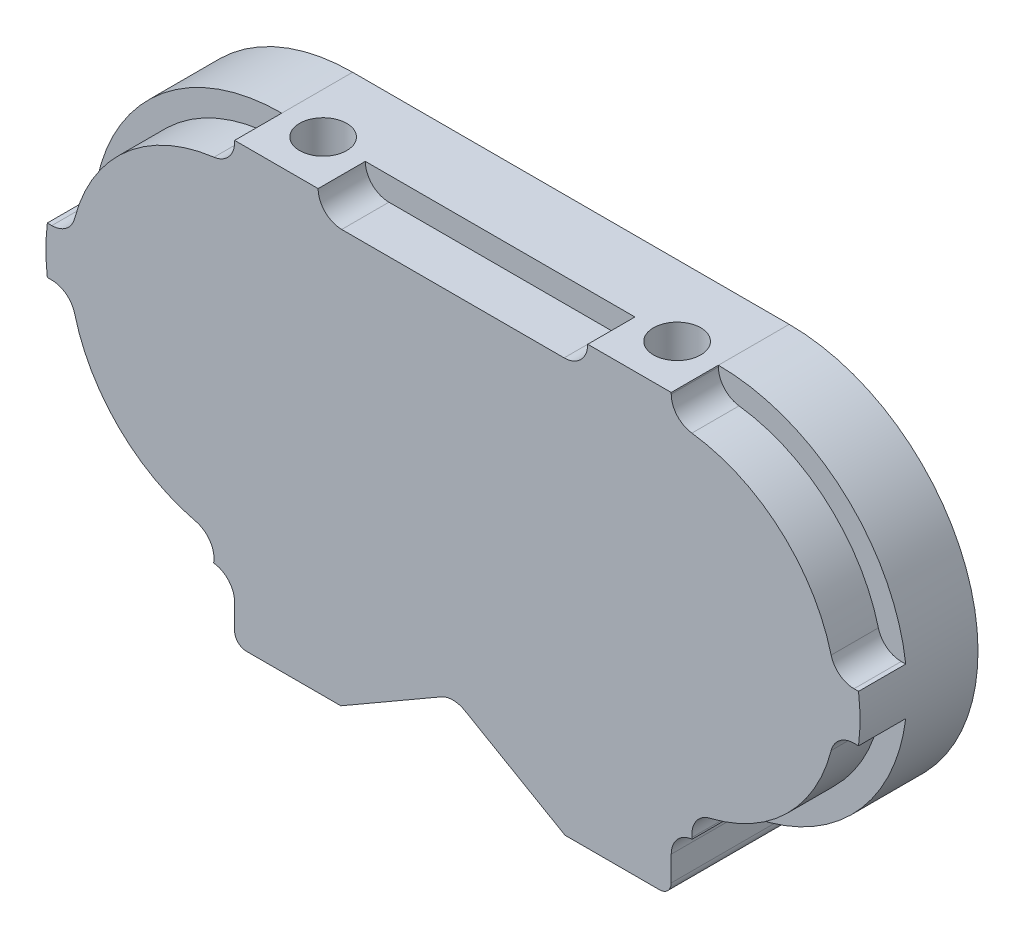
SolidWorks part; units mm, degrees
ref_plane "Front Plane" through (0, 0, 0) normal (0, 0, 1) x (1, 0, 0)
ref_plane "Top Plane" through (0, 0, 0) normal (0, 1, 0) x (1, 0, 0)
ref_plane "Right Plane" through (0, 0, 0) normal (1, 0, 0) x (0, 0, -1)
sketch "Sketch1" plane through (0, 0, 0) normal (0, 0, 1) x (1, 0, 0)
  line L0 (13, 32) -> (87, 32)
  line L1 (0, 0) -> (100, 0) construction
  line L3 (13, -35.7771) -> (13, -40)
  line L4 (15, -42) -> (31, -42)
  line L5 (48, -32.185) -> (31, -42)
  line L6 (50, 0) -> (50, -58.0487) construction
  line L7 (52, -32.185) -> (69, -42)
  line L8 (69, -42) -> (85, -42)
  line L9 (87, -40) -> (87, -35.7771)
  arc A1 (13, 32) -> (9.4444, -31.8019) centre (13, 0) ccw
  arc A2 (90.5556, -31.8019) -> (87, 32) centre (87, 0) ccw
  arc A4 (48, -32.185) -> (52, -32.185) centre (50, -35.6491) cw
  arc A5 (87, -35.7771) -> (90.5556, -31.8019) centre (91, -35.7771) cw
  arc A6 (13, -35.7771) -> (9.4444, -31.8019) centre (9, -35.7771) ccw
  arc A7 (85, -42) -> (87, -40) centre (85, -40) ccw
  arc A8 (13, -40) -> (15, -42) centre (15, -40) ccw
  point P21 (50, -31.0303)
  point P23 (87, -32)
  point P26 (13, -32)
  point P29 (87, -42)
  point P32 (13, -42)
  dimension "D1" = 74
  dimension "D2" = 32
  dimension "D5" = 10
  dimension "D3" = 10
  dimension "D8" = 4
  dimension "D9" = 18
  dimension "D10" = 18
  dimension "D11" = 4
  dimension "D12" = 2
  dimension "D13" = 2
  dimension "D4" = 100
  dimension "D6" = 120
  dimension "D7" = 60
extrude "Extrude1" add sketch "Sketch1" along normal blind 20
ref_plane "Plane1" through (0, -42, 0) normal (0, 1, 0) x (-1, 0, 0)
sketch "Sketch8" plane through (0, -42, 0) normal (0, 1, 0) x (-1, 0, 0)
  line L0 (-48, 20) -> (-52, 20) construction
  line L1 (-15, 20) -> (-31, 20) construction
  line L2 (-69, 20) -> (-85, 20) construction
  circle A0 centre (-20, 12) radius 4
  circle A1 centre (-80, 12) radius 4
  point P4 (-50, 20)
  point P13 (-23, 20)
  point P14 (-77, 20)
  dimension "D3" = 8
  dimension "D4" = 8
  dimension "D5" = 8
  dimension "D6" = 8
  dimension "D1" = 60
  dimension "D2" = 30
extrude "Extrude3" cut sketch "Sketch8" along normal blind 100
sketch "Sketch12" plane through (0, 0, 20) normal (0, 0, 1) x (1, 0, 0)
  line L0 (9.4444, -31.8019) -> (9.4723, -31.5524)
  line L1 (87, 32) -> (13, 32) construction
  line L2 (68.8491, 28) -> (31.1509, 28)
  line L4 (117.9839, 4) -> (118.749, 4)
  line L5 (-17.9839, 4) -> (-18.749, 4)
  line L6 (117.9839, -4) -> (118.749, -4)
  line L7 (-17.9839, -4) -> (-18.749, -4)
  line L8 (72.8491, 32) -> (27.1509, 32)
  line L9 (90.5277, -31.5524) -> (90.5556, -31.8019)
  line L10 (90.5556, -31.8019) -> (90.4647, -31.5578)
  line L11 (13, 32) -> (13, 31.749)
  line L12 (87, 32) -> (87, 31.749)
  line L13 (87, 28) -> (13, 28) construction
  line L15 (87, 32) -> (13, 32) construction
  arc A0 (90.5556, -31.8019) -> (87, 32) centre (87, 0) ccw construction
  arc A1 (13, 32) -> (9.4444, -31.8019) centre (13, 0) ccw construction
  arc A2 (90.5556, -31.8019) -> (118.749, -4) centre (87, 0) ccw
  arc A3 (13, 32) -> (-18.749, 4) centre (13, 0) ccw
  arc A4 (90.5, 27.7804) -> (114.1109, 7) centre (87, 0) cw
  arc A5 (-14.1109, -7) -> (-17.9839, -4) centre (-17.9839, -8) ccw
  arc A6 (13, 28) -> (9.8889, -27.8266) centre (13, 0) ccw construction
  arc A7 (-14.1109, 7) -> (-17.9839, 4) centre (-17.9839, 8) cw
  arc A8 (9.5, 27.7804) -> (-14.1109, 7) centre (13, 0) ccw
  arc A9 (-14.1109, -7) -> (6.435, -27.2195) centre (13, 0) ccw
  arc A10 (13, 28) -> (9.8889, -27.8266) centre (13, 0) ccw construction
  arc A11 (90.1111, -27.8266) -> (87, 28) centre (87, 0) ccw construction
  arc A12 (114.1109, -7) -> (93.565, -27.2195) centre (87, 0) cw
  arc A13 (114.1109, -7) -> (117.9839, -4) centre (117.9839, -8) cw
  arc A14 (114.1109, 7) -> (117.9839, 4) centre (117.9839, 8) ccw
  arc A15 (90.5556, -31.8019) -> (87, 32) centre (87, 0) ccw construction
  arc A16 (9.5, 27.7804) -> (13, 31.749) centre (9, 31.749) ccw
  arc A17 (90.5, 27.7804) -> (87, 31.749) centre (91, 31.749) cw
  arc A18 (27.1509, 32) -> (31.1509, 28) centre (31.1509, 32) ccw
  arc A19 (72.8491, 32) -> (68.8491, 28) centre (68.8491, 32) cw
  arc A20 (6.435, -27.2195) -> (9.4723, -31.5524) centre (5.4971, -31.108) cw
  arc A21 (93.565, -27.2195) -> (90.5277, -31.5524) centre (94.5029, -31.108) ccw
  arc A22 (-18.749, -4) -> (9.4444, -31.8019) centre (13, 0) ccw
  arc A23 (13, 32) -> (9.4444, -31.8019) centre (13, 0) ccw construction
  arc A24 (90.5556, -31.8019) -> (118.749, -4) centre (87, 0) ccw
  arc A25 (118.749, 4) -> (87, 32) centre (87, 0) ccw
  dimension "D4" = 4
  dimension "D5" = 4
  dimension "D6" = 4
  dimension "D2" = 4
  dimension "D1" = 4
extrude "Extrude6" cut sketch "Sketch12" against normal blind 8 contours A20 L0 A22 L7 A5 A9 | A17 L12 A25 L4 A14 A4 | L2 A18 L8 A19 | A8 A7 L5 A3 L11 A16 | A21 A12 A13 L6 A2 L9
sketch "Sketch14" plane through (0, 0, 0) normal (0, 0, -1) x (-1, 0, 0)
  line L0 (-87, 32) -> (-13, 32) construction
  line L1 (-87, 32) -> (-13, 32)
  line L2 (-90.5556, -31.8019) -> (-9.4444, -31.8019)
  line L3 (-90.3252, -27.8019) -> (-9.6748, -27.8019)
  line L4 (-87, 28) -> (-13, 28)
  line L12 (-89.946, -21.8019) -> (-10.054, -21.8019)
  line L13 (-87, 22) -> (-13, 22)
  arc A0 (-9.4444, -31.8019) -> (-13, 32) centre (-13, 0) ccw construction
  arc A1 (-87, 32) -> (-90.5556, -31.8019) centre (-87, 0) ccw construction
  arc A2 (-9.4444, -31.8019) -> (-13, 32) centre (-13, 0) ccw
  arc A3 (-87, 32) -> (-90.5556, -31.8019) centre (-87, 0) ccw
  arc A4 (-87, 28) -> (-90.3252, -27.8019) centre (-87, 0) ccw
  arc A5 (-9.6748, -27.8019) -> (-13, 28) centre (-13, 0) ccw
  arc A13 (-87, 22) -> (-89.946, -21.8019) centre (-87, 0) ccw
  arc A14 (-10.054, -21.8019) -> (-13, 22) centre (-13, 0) ccw
extrude "Extrude9" cut sketch "Sketch14" against normal blind 7 contours L13 A14 L12 A13 | L4 A5 L3 A4
sketch "Sketch15" plane through (0, 0, 0) normal (0, 0, -1) x (-1, 0, 0)
  line L1 (-26, -18) -> (-74, -18)
  line L2 (-26, -18) -> (-26, 18)
  line L3 (-26, 18) -> (-74, 18)
  line L4 (-74, -18) -> (-74, 18)
  line L5 (-26, -18) -> (-74, 18) construction
  line L6 (-26, 18) -> (-74, -18) construction
  point P0 (-50, 0)
  dimension "D1" = 36
  dimension "D2" = 48
extrude "Extrude10" cut sketch "Sketch15" against normal blind 14
sketch "Sketch16" plane through (0, 0, 0) normal (0, 0, -1) x (-1, 0, 0)
  line L1 (-26, -18) -> (-26, 18) construction
  line L2 (-74, 18) -> (-74, -18) construction
  line L3 (-74, 18) -> (-74, -18)
  line L4 (-26, -18) -> (-26, 18)
  arc A0 (-74, 18) -> (-74, -18) centre (-74, 0) ccw
  arc A1 (-26, -18) -> (-26, 18) centre (-26, 0) ccw
extrude "Extrude12" cut sketch "Sketch16" against normal blind 6
chamfer "Chamfer1" distance 1.5 angle 45 3 edges at (-14.9504, 1.6655, 0) (50, 28, 0) (114.9504, 1.6655, 0)
chamfer "Chamfer2" distance 1.5 angle 45 1 edges at (50, -27.8019, 0)
sketch "Sketch17" plane through (0, 0, 0) normal (0, 0, -1) x (-1, 0, 0)
  circle A2 centre (-100, 0) radius 3.25
  circle A3 centre (0, 0) radius 3.25
  dimension "D1" = 100
extrude "Extrude13" cut sketch "Sketch17" against normal blind 15
